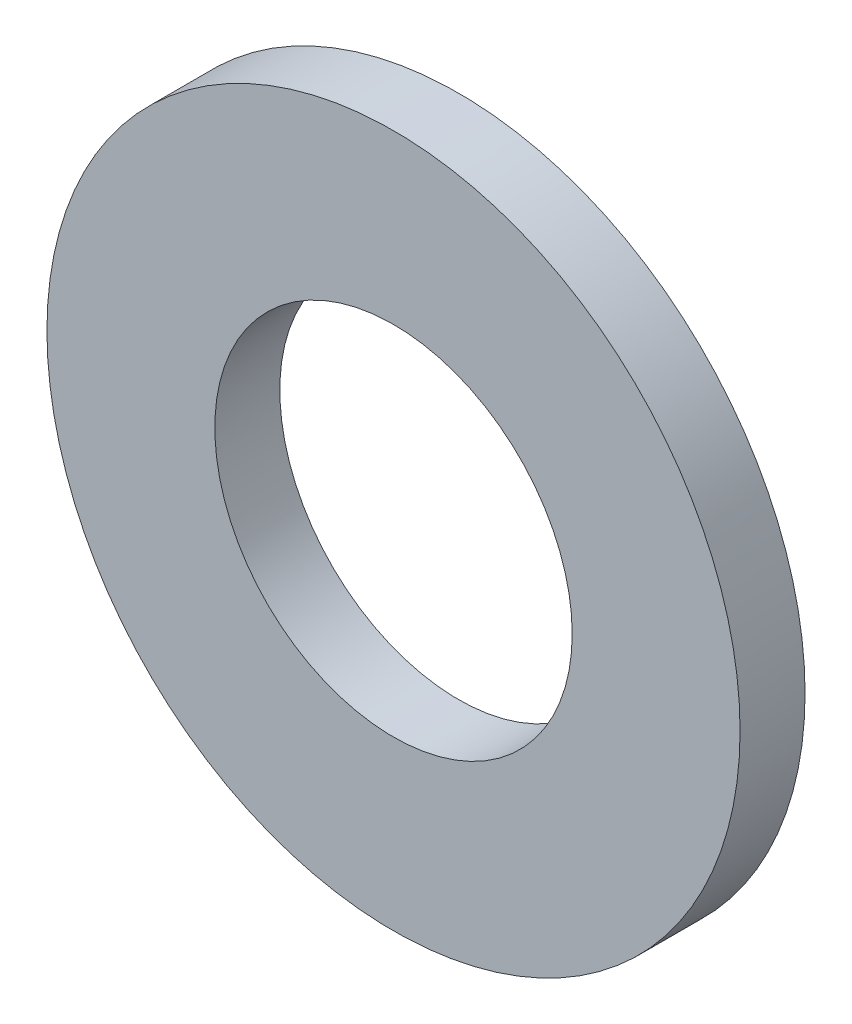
SolidWorks part; units mm, degrees
ref_plane "Plan de face" through (0, 0, 0) normal (0, 0, 1) x (1, 0, 0)
ref_plane "Plan de dessus" through (0, 0, 0) normal (0, 1, 0) x (1, 0, 0)
ref_plane "Plan de droite" through (0, 0, 0) normal (1, 0, 0) x (0, 0, -1)
sketch "Esquisse1" plane through (0, 0, 0) normal (0, 0, 1) x (1, 0, 0)
  circle A0 centre (0, 0) radius 16
  circle A1 centre (0, 0) radius 8.25
  dimension "D1" = 32
  dimension "D2" = 16.5
extrude "Extrusion1" add sketch "Esquisse1" along normal blind 3
